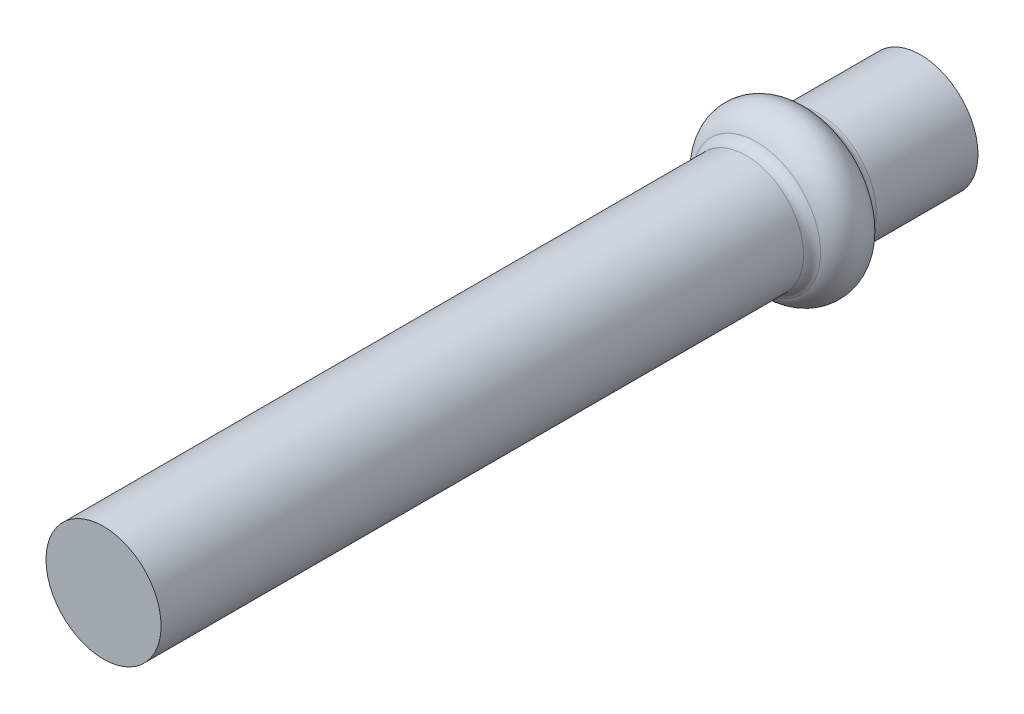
SolidWorks part; units mm, degrees
ref_plane "Plan1" through (0, 0, 0) normal (0, 0, 1) x (1, 0, 0)
ref_plane "Plan2" through (0, 0, 0) normal (0, 1, 0) x (1, 0, 0)
ref_plane "Plan3" through (0, 0, 0) normal (1, 0, 0) x (0, 0, -1)
sketch "Esquisse1" plane through (0, 0, 0) normal (0, 0, 1) x (1, 0, 0)
  circle A0 centre (0, 0) radius 5
  dimension "D1" = 10
extrude "Base-Extrusion" add sketch "Esquisse1" along normal blind 71
sketch "Esquisse4" plane through (0, 0, 0) normal (1, 0, 0) x (0, 0, -1)
  line L0 (0, 0) -> (-20, 0) construction
  line L1 (-71, 0) -> (0, 0) construction
  line L5 (0, 5) -> (-71, 5) construction
  line L6 (-14.4495, 5) -> (-9.5505, 5)
  line L7 (0, -5) -> (0, 5) construction
  arc A0 (-14.4495, 5) -> (-9.5505, 5) centre (-12, 4.5) cw
  dimension "D1" = 0.5
  dimension "D3" = 2.5
  dimension "D2" = 12
revolve "Boss.-Révol.1" add sketch "Esquisse4" angle 360 about L0
fillet "Congé1" radius 1 1 edges at (-5, 0, 14.4495)
fillet "Congé2" radius 1 1 edges at (5, 0, 9.5505)
ref_plane "Plan4" through (0, 0, 71) normal (0, 0, 1) x (1, 0, 0)
sketch "Esquisse5" plane through (0, 0, 0) normal (1, 0, 0) x (0, 0, -1)
  line L1 (0, -5) -> (0, 5) construction
  line L4 (-15.1623, 4) -> (-61, 4)
  line L5 (0, 4) -> (-8.8377, 4)
  line L6 (-71, 5) -> (-71, -5) construction
  line L7 (0, 4) -> (0, 0)
  line L8 (0, 0) -> (-65, 0)
  line L9 (-71, 0) -> (-5.1368, 0) construction
  line L10 (-8.8377, 0) -> (0, 0) construction
  arc A1 (-61, 4) -> (-65, 0) centre (-61, 0) ccw
  arc A6 (-15.1623, 4) -> (-13.3553, 5.1429) centre (-15.1623, 6) ccw
  arc A7 (-10.6447, 5.1429) -> (-13.3553, 5.1429) centre (-12, 4.5) ccw
  arc A8 (-10.6447, 5.1429) -> (-8.8377, 4) centre (-8.8377, 6) ccw
  dimension "D3" = 12
  dimension "D4" = 1.5
  dimension "D6" = 8
  dimension "D2" = 4
  dimension "D1" = 4
  dimension "D5" = 4.5
  dimension "D7" = 10
revolve "Enlèvement de matière-Révolution1" cut sketch "Esquisse5" angle 360 about L9
